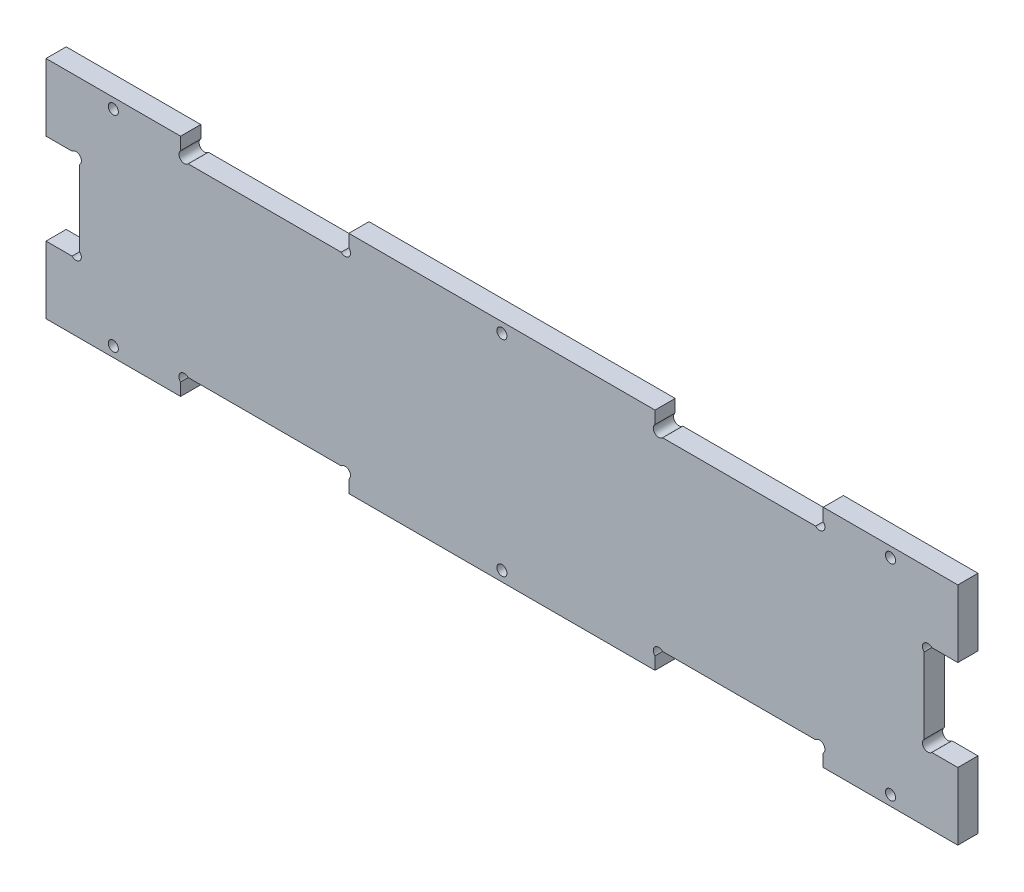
SolidWorks part; units mm, degrees
ref_plane "Face" through (0, 0, 0) normal (0, 0, 1) x (1, 0, 0)
ref_plane "Dessus" through (0, 0, 0) normal (0, 1, 0) x (1, 0, 0)
ref_plane "Droite" through (0, 0, 0) normal (1, 0, 0) x (0, 0, -1)
sketch "Esquisse1" plane through (0, 0, 0) normal (0, 0, 1) x (1, 0, 0)
  line L0 (221.3383, -17.9999) -> (-49.6617, -17.9999)
  line L1 (-49.6617, 37.0001) -> (221.3383, 37.0001)
  line L2 (-49.6617, 37.0001) -> (-49.6617, -17.9999)
  line L4 (221.3383, 37.0001) -> (221.3383, -17.9999)
  dimension "D1" = 271
  dimension "D2" = 55
extrude "Base-Extrusion" add sketch "Esquisse1" along normal blind 6
sketch "Esquisse4" plane through (0, -17.9999, 0) normal (0, -1, 0) x (1, 0, 0)
  line L0 (-49.6617, 6) -> (221.3383, 6) construction
  line L1 (181.3383, 6) -> (221.3383, 6)
  line L2 (181.3383, 6) -> (181.3383, 0)
  line L3 (181.3383, 0) -> (221.3383, 0)
  line L4 (221.3383, 6) -> (221.3383, 0)
  line L5 (-49.6617, 0) -> (221.3383, 0) construction
  line L7 (-49.6617, 6) -> (-9.6617, 6)
  line L8 (-49.6617, 6) -> (-49.6617, 0)
  line L9 (-49.6617, 0) -> (-9.6617, 0)
  line L10 (40.3383, 6) -> (131.3383, 6)
  line L11 (40.3383, 6) -> (40.3383, 0)
  line L12 (40.3383, 0) -> (131.3383, 0)
  line L13 (131.3383, 6) -> (131.3383, 0)
  line L14 (-9.6617, 6) -> (-9.6617, 0)
  dimension "D1" = 40
  dimension "D2" = 40
  dimension "D3" = 50
  dimension "D4" = 50
extrude "Extrusion1" add sketch "Esquisse4" along normal blind 6
sketch "Esquisse6" plane through (0, 37.0001, 0) normal (0, 1, 0) x (-1, 0, 0)
  line L0 (-221.3383, 0) -> (49.6617, 0) construction
  line L1 (49.6617, 6) -> (9.6617, 6)
  line L2 (49.6617, 6) -> (49.6617, 0)
  line L3 (49.6617, 0) -> (9.6617, 0)
  line L4 (9.6617, 6) -> (9.6617, 0)
  line L5 (-221.3383, 6) -> (49.6617, 6) construction
  line L6 (-40.3383, 6) -> (-131.3383, 6)
  line L7 (-40.3383, 6) -> (-40.3383, 0)
  line L8 (-40.3383, 0) -> (-131.3383, 0)
  line L9 (-131.3383, 6) -> (-131.3383, 0)
  line L11 (-221.3383, 6) -> (-181.3383, 6)
  line L12 (-221.3383, 6) -> (-221.3383, 0)
  line L13 (-221.3383, 0) -> (-181.3383, 0)
  line L14 (-181.3383, 6) -> (-181.3383, 0)
  dimension "D1" = 40
  dimension "D2" = 50
  dimension "D3" = 40
  dimension "D4" = 50
extrude "Extrusion2" add sketch "Esquisse6" along normal blind 6
sketch "Esquisse2" plane through (0, 0, 6) normal (0, 0, 1) x (1, 0, 0)
  line L1 (221.3383, -23.9999) -> (221.3383, 43.0001) construction
  line L4 (-49.6617, 37.0001) -> (-49.6617, -17.9999) construction
  line L5 (131.3383, -23.9999) -> (40.3383, -23.9999) construction
  line L6 (221.3383, -23.9999) -> (181.3383, -23.9999) construction
  line L7 (-9.6617, -23.9999) -> (-49.6617, -23.9999) construction
  line L8 (181.3383, 43.0001) -> (221.3383, 43.0001) construction
  line L9 (221.3383, -23.9999) -> (221.3383, 43.0001) construction
  line L10 (40.3383, 43.0001) -> (131.3383, 43.0001) construction
  line L11 (-49.6617, 43.0001) -> (-49.6617, -23.9999) construction
  line L12 (-49.6617, 43.0001) -> (-9.6617, 43.0001) construction
  circle A0 centre (201.3383, -20.9999) radius 1.5
  circle A1 centre (85.8383, -20.9999) radius 1.5
  circle A2 centre (-29.6617, -20.9999) radius 1.5
  circle A3 centre (-29.6617, 40.0001) radius 1.5
  circle A4 centre (85.8383, 40.0001) radius 1.5
  circle A5 centre (201.3383, 40.0001) radius 1.5
  dimension "D1" = 3
  dimension "D2" = 3
  dimension "D3" = 3
  dimension "D10" = 3
  dimension "D4" = 3
  dimension "D5" = 20
  dimension "D6" = 3
  dimension "D7" = 3
  dimension "D8" = 20
  dimension "D9" = 135.5
  dimension "D11" = 20
  dimension "D12" = 3
  dimension "D13" = 135.5
  dimension "D14" = 3
  dimension "D15" = 20
extrude "Enlèv. mat.-Extru.3" cut sketch "Esquisse2" against normal up to vertex (6 mm away)
sketch "Esquisse7" plane through (0, 0, 6) normal (0, 0, 1) x (1, 0, 0)
  line L0 (221.3383, -23.9999) -> (221.3383, 43.0001) construction
  line L1 (221.3383, -3.9999) -> (211.3383, -3.9999)
  line L2 (221.3383, -3.9999) -> (221.3383, 23.0001)
  line L3 (221.3383, 23.0001) -> (211.3383, 23.0001)
  line L4 (211.3383, -3.9999) -> (211.3383, 23.0001)
  line L5 (-49.6617, 43.0001) -> (-49.6617, -23.9999) construction
  line L6 (-49.6617, -3.9999) -> (-39.6617, -3.9999)
  line L7 (-49.6617, -3.9999) -> (-49.6617, 23.0001)
  line L8 (-49.6617, 23.0001) -> (-39.6617, 23.0001)
  line L9 (-39.6617, -3.9999) -> (-39.6617, 23.0001)
  line L10 (221.3383, -23.9999) -> (181.3383, -23.9999) construction
  line L11 (181.3383, 43.0001) -> (221.3383, 43.0001) construction
  line L12 (-9.6617, -23.9999) -> (-49.6617, -23.9999) construction
  line L13 (-49.6617, 43.0001) -> (-9.6617, 43.0001) construction
  dimension "D1" = 10
  dimension "D2" = 20
  dimension "D3" = 20
  dimension "D4" = 10
  dimension "D5" = 20
  dimension "D6" = 20
extrude "Enlèv. mat.-Extru.4" cut sketch "Esquisse7" against normal up to vertex (6 mm away)
sketch "Esquisse5" plane through (0, 0, 6) normal (0, 0, 1) x (1, 0, 0)
  line L0 (40.3383, -23.9999) -> (40.3383, -17.9999) construction
  line L1 (-9.6617, -17.9999) -> (40.3383, -17.9999) construction
  line L2 (-9.6617, -23.9999) -> (-9.6617, -17.9999) construction
  line L3 (181.3383, -23.9999) -> (181.3383, -17.9999) construction
  line L4 (131.3383, -23.9999) -> (131.3383, -17.9999) construction
  line L5 (131.3383, -17.9999) -> (181.3383, -17.9999) construction
  line L6 (131.3383, 43.0001) -> (131.3383, 37.0001) construction
  line L7 (181.3383, 43.0001) -> (181.3383, 37.0001) construction
  line L8 (181.3383, 37.0001) -> (131.3383, 37.0001) construction
  line L9 (-9.6617, 43.0001) -> (-9.6617, 37.0001) construction
  line L10 (40.3383, 43.0001) -> (40.3383, 37.0001) construction
  line L11 (40.3383, 37.0001) -> (-9.6617, 37.0001) construction
  line L12 (211.3383, -3.9999) -> (221.3383, -3.9999) construction
  line L13 (221.3383, 23.0001) -> (211.3383, 23.0001) construction
  line L14 (211.3383, 23.0001) -> (211.3383, -3.9999) construction
  line L15 (-39.6617, 23.0001) -> (-49.6617, 23.0001) construction
  line L16 (-49.6617, -3.9999) -> (-39.6617, -3.9999) construction
  line L17 (-39.6617, -3.9999) -> (-39.6617, 23.0001) construction
  circle A0 centre (39.2383, -19.0999) radius 1.6
  circle A1 centre (-8.5617, -19.0999) radius 1.6
  circle A2 centre (180.2383, -19.0999) radius 1.6
  circle A3 centre (132.4383, -19.0999) radius 1.6
  circle A4 centre (132.4383, 38.1001) radius 1.6
  circle A5 centre (180.2383, 38.1001) radius 1.6
  circle A6 centre (-8.5617, 38.1001) radius 1.6
  circle A7 centre (39.2383, 38.1001) radius 1.6
  circle A8 centre (212.4383, -2.8999) radius 1.6
  circle A9 centre (212.4383, 21.9001) radius 1.6
  circle A10 centre (-40.7617, -2.8999) radius 1.6
  circle A11 centre (-40.7617, 21.9001) radius 1.6
  point P24 (131.3383, 40.0001)
  dimension "D5" = 1.1
  dimension "D9" = 1.1
  dimension "D17" = 1.1
  dimension "D21" = 1.1
  dimension "D1" = 1.1
  dimension "D2" = 1.1
  dimension "D3" = 1.1
  dimension "D4" = 1.1
  dimension "D6" = 1.1
  dimension "D7" = 1.1
  dimension "D8" = 1.1
  dimension "D10" = 1.1
  dimension "D11" = 1.1
  dimension "D12" = 1.1
  dimension "D13" = 1.1
  dimension "D14" = 1.1
  dimension "D15" = 1.1
  dimension "D16" = 1.1
  dimension "D18" = 1.1
  dimension "D19" = 1.1
  dimension "D20" = 1.1
  dimension "D22" = 1.1
  dimension "D23" = 1.1
  dimension "D24" = 1.1
extrude "Enlèv. mat.-Extru.2" cut sketch "Esquisse5" against normal up to vertex (6 mm away)
